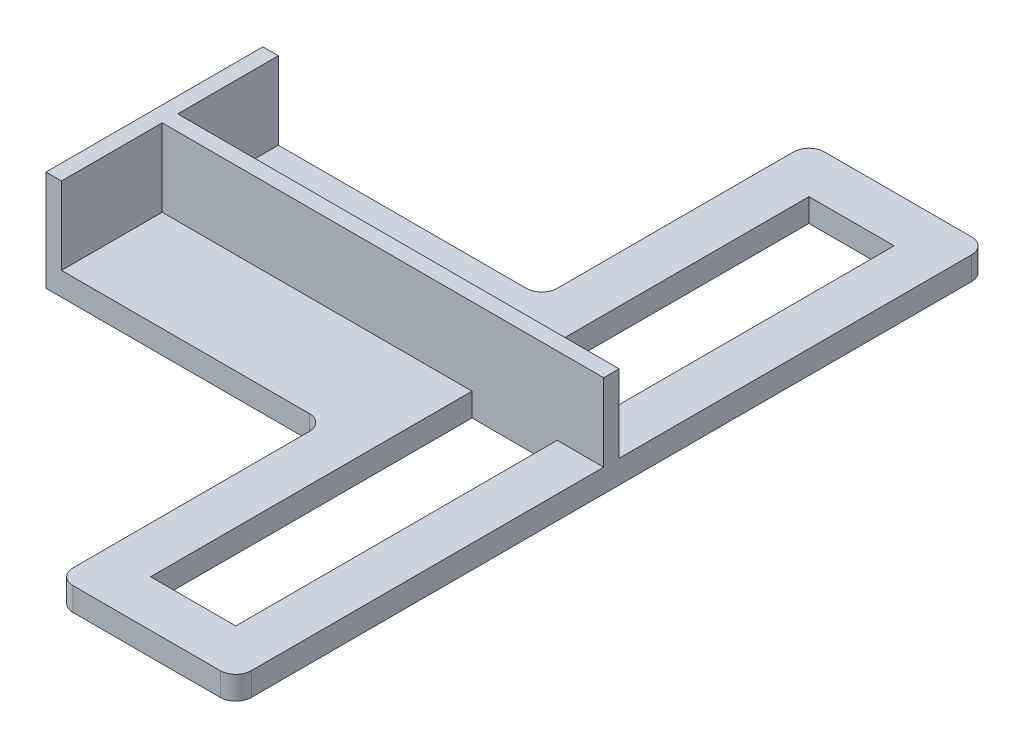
SolidWorks part; units mm, degrees
ref_plane "Front Plane" through (0, 0, 0) normal (0, 0, 1) x (1, 0, 0)
ref_plane "Top Plane" through (0, 0, 0) normal (0, 1, 0) x (1, 0, 0)
ref_plane "Right Plane" through (0, 0, 0) normal (1, 0, 0) x (0, 0, -1)
sketch "Sketch1" plane through (0, 0, 0) normal (0, 1, 0) x (1, 0, 0)
  line L0 (-5.5, 22.75) -> (-5.5, 64.25)
  line L1 (5.5, -20.75) -> (-5.5, -20.75)
  line L2 (5.5, -20.75) -> (5.5, 20.75)
  line L4 (-5.5, -20.75) -> (-5.5, 20.75)
  line L5 (5.5, -20.75) -> (-5.5, 20.75) construction
  line L6 (5.5, 20.75) -> (-5.5, -20.75) construction
  line L7 (-47.5, 7.75) -> (-47.5, 35.75)
  line L8 (5.5, 20.75) -> (-5.5, 20.75) construction
  line L9 (-5.5, 64.25) -> (5.5, 64.25)
  line L10 (-11.5, 7.75) -> (-47.5, 7.75)
  line L11 (11.5011, 70.25) -> (11.5011, -26.75)
  line L12 (-5.5, 22.75) -> (5.5, 22.75)
  line L13 (11.5011, -26.75) -> (-11.5, -26.75)
  line L15 (-47.5, 21.75) -> (11.5011, 21.75) construction
  line L19 (-47.5, 35.75) -> (-11.5, 35.75)
  line L20 (-11.5, 7.75) -> (-11.5, -26.75)
  line L21 (-5.5, 20.75) -> (5.5, 20.75)
  line L22 (5.5, 64.25) -> (5.5, 22.75)
  line L24 (11.5011, 70.25) -> (-11.5, 70.25)
  line L25 (-11.5, 70.25) -> (-11.5, 35.75)
  point P0 (0, 0)
  dimension "D1" = 11
  dimension "D2" = 41.5
  dimension "D3" = 42
  dimension "D4" = 6
  dimension "D5" = 28
  dimension "D6" = 6
  dimension "D7" = 6
  dimension "D8" = 6.0011
  dimension "D9" = 6
  dimension "D10" = 2
extrude "Boss-Extrude1" add sketch "Sketch1" along normal blind 3
fillet "Fillet1" radius 2 6 edges at (-11.5, 1.5, 26.75) (-11.5, 1.5, -70.25) (-11.5, 1.5, -35.75) (-11.5, 1.5, -7.75) (11.5011, 1.5, 26.75) (11.5011, 1.5, -70.25)
sketch "Sketch2" plane through (0, 3, 0) normal (0, 1, 0) x (1, 0, 0)
  line L0 (11.5011, 22.75) -> (-45.5, 22.75)
  line L2 (-45.5, 20.75) -> (-45.5, 7.75)
  line L3 (-13.5, 7.75) -> (-47.5, 7.75) construction
  line L4 (-45.5, 7.75) -> (-47.5, 7.75)
  line L5 (-47.5, 7.75) -> (-47.5, 35.75)
  line L6 (-47.5, 35.75) -> (-45.5, 35.75)
  line L7 (-47.5, 35.75) -> (-13.5, 35.75) construction
  line L8 (-45.5, 35.75) -> (-45.5, 22.75)
  line L9 (-45.5, 20.75) -> (11.5011, 20.75)
  line L10 (11.5011, 20.75) -> (11.5011, 22.75)
  line L11 (-5.5, 20.75) -> (5.5, 20.75) construction
  line L12 (-5.5, 22.75) -> (5.5, 22.75) construction
  line L14 (11.5011, 68.25) -> (11.5011, -24.75) construction
  dimension "D1" = 2
extrude "Boss-Extrude2" add sketch "Sketch2" along normal blind 10
